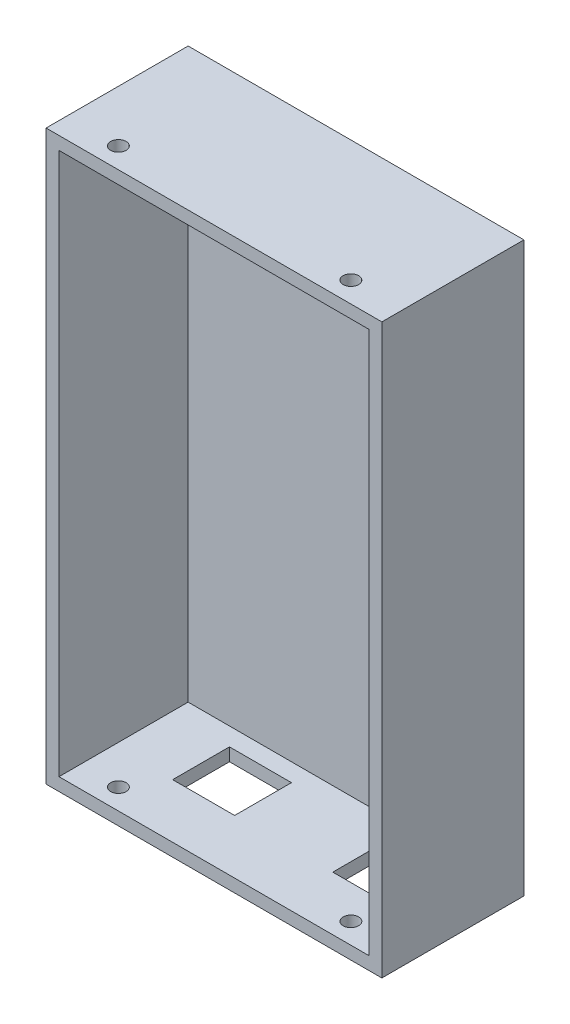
SolidWorks part; units mm, degrees
ref_plane "Front Plane" through (0, 0, 0) normal (0, 0, 1) x (1, 0, 0)
ref_plane "Top Plane" through (0, 0, 0) normal (0, 1, 0) x (1, 0, 0)
ref_plane "Right Plane" through (0, 0, 0) normal (1, 0, 0) x (0, 0, -1)
sketch "Sketch2" plane through (0, 0, 0) normal (0, 0, 1) x (1, 0, 0)
  line L1 (-32.5, 55) -> (32.5, 55)
  line L2 (-32.5, 55) -> (-32.5, -55)
  line L3 (-32.5, -55) -> (32.5, -55)
  line L4 (32.5, 55) -> (32.5, -55)
  line L5 (-32.5, 55) -> (32.5, -55) construction
  line L6 (-32.5, -55) -> (32.5, 55) construction
  point P0 (0, 0)
  dimension "D1" = 110
  dimension "D2" = 65
extrude "Boss-Extrude1" add sketch "Sketch2" along normal blind 2.5
sketch "Sketch3" plane through (0, 0, 2.5) normal (0, 0, 1) x (1, 0, 0)
  line L8 (30, -52.5) -> (30, 52.5)
  line L9 (30, 52.5) -> (-30, 52.5)
  line L10 (-30, 52.5) -> (-30, -52.5)
  line L11 (-30, -52.5) -> (30, -52.5)
  line L12 (30, -52.5) -> (30, 52.5)
  line L13 (30, 52.5) -> (-30, 52.5)
  line L14 (-30, 52.5) -> (-30, -52.5)
  line L15 (-30, -52.5) -> (30, -52.5)
  line L16 (-32.5, 55) -> (-32.5, -55)
  line L17 (-32.5, -55) -> (32.5, -55)
  line L18 (32.5, -55) -> (32.5, 55)
  line L19 (32.5, 55) -> (-32.5, 55)
  dimension "D1" = 2.5
  dimension "D2" = 2.5
extrude "Boss-Extrude2" add sketch "Sketch3" along normal blind 25
sketch "Sketch4" plane through (0, -55, 0) normal (0, -1, 0) x (1, 0, 0)
  line L5 (-18.5, 6) -> (-18.5, 17)
  line L6 (-18.5, 17) -> (-6.5, 17)
  line L7 (-6.5, 17) -> (-6.5, 6)
  line L9 (22, 6) -> (22, 17)
  line L10 (22, 17) -> (12.5, 17)
  line L11 (12.5, 17) -> (12.5, 6)
  line L13 (12.5, 6) -> (22, 6)
  line L14 (-18.5, 6) -> (-6.5, 6)
  line L17 (-32.5, 27.5) -> (-32.5, 0) construction
  line L18 (-32.5, 0) -> (32.5, 0) construction
  dimension "D1" = 6
  dimension "D2" = 11
  dimension "D3" = 12
  dimension "D4" = 14
  dimension "D5" = 19
  dimension "D7" = 11
  dimension "D8" = 9.5
extrude "Cut-Extrude3" cut sketch "Sketch4" against normal blind 17
sketch "Sketch5" plane through (0, -55, 0) normal (0, -1, 0) x (-1, 0, 0)
  line L0 (32.5, -27.5) -> (-32.5, -27.5) construction
  line L1 (32.5, -27.5) -> (32.5, 0) construction
  line L3 (-32.5, -27.5) -> (-32.5, 0) construction
  circle A0 centre (22.5, -23.5) radius 1.5
  circle A1 centre (-22.5, -23.5) radius 1.5
  dimension "D2" = 3
  dimension "D3" = 10
  dimension "D4" = 10
  dimension "D5" = 3
  dimension "D1" = 4
  dimension "D6" = 4
extrude "Cut-Extrude4" cut sketch "Sketch5" against normal through all
